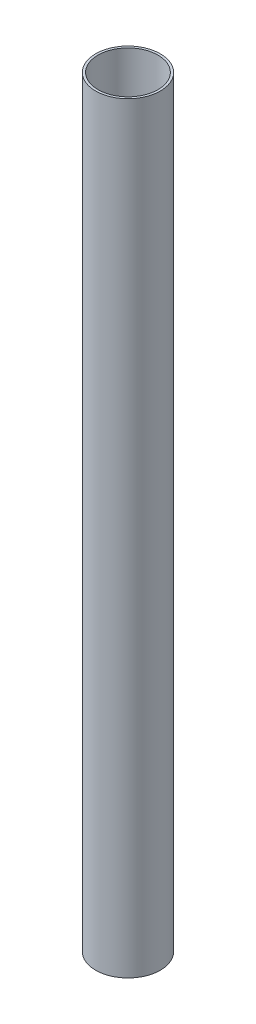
SolidWorks part; units mm, degrees
ref_plane "Front Plane" through (0, 0, 0) normal (0, 0, 1) x (1, 0, 0)
ref_plane "Top Plane" through (0, 0, 0) normal (0, 1, 0) x (1, 0, 0)
ref_plane "Right Plane" through (0, 0, 0) normal (1, 0, 0) x (0, 0, -1)
sketch "Sketch2" plane through (0, 0, 0) normal (0, 1, 0) x (1, 0, 0)
  circle A0 centre (0, 0) radius 14
  circle A1 centre (0, 0) radius 13
  dimension "D1" = 28
  dimension "D2" = 26
extrude "Boss-Extrude1" add sketch "Sketch2" against normal blind 330
